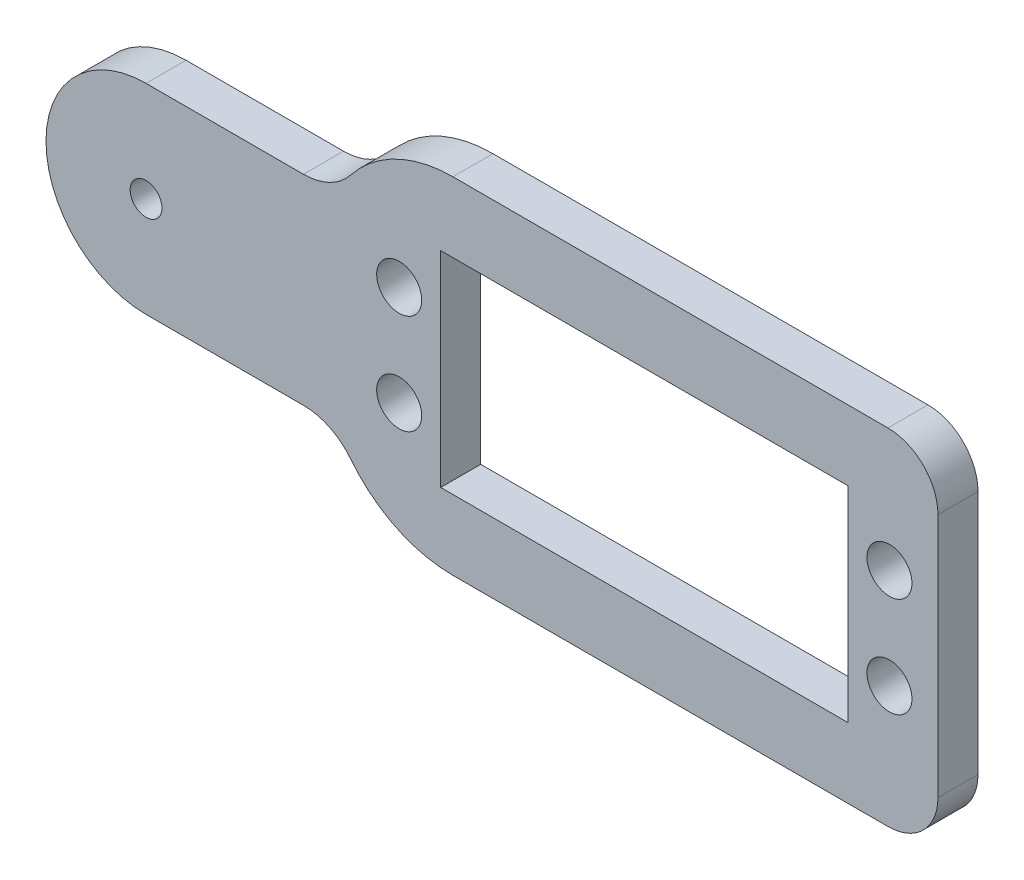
SolidWorks part; units mm, degrees
ref_plane "Front Plane" through (0, 0, 0) normal (0, 0, 1) x (1, 0, 0)
ref_plane "Top Plane" through (0, 0, 0) normal (0, 1, 0) x (1, 0, 0)
ref_plane "Right Plane" through (0, 0, 0) normal (1, 0, 0) x (0, 0, -1)
sketch "Sketch1" plane through (0, 0, 0) normal (0, 0, 1) x (1, 0, 0)
  line L0 (-59.8, 0) -> (29.35, 0) construction
  line L1 (29.35, -12.25) -> (29.35, 12.25)
  line L2 (24.35, 17.25) -> (-19.134, 17.25)
  line L3 (-34.0651, 10) -> (-49.8, 10)
  line L4 (-34.0651, -10) -> (-49.8, -10)
  line L5 (24.35, -17.25) -> (-19.134, -17.25)
  line L32 (-24.5, -5) -> (24.5, 5) construction
  line L33 (20.35, 10.25) -> (-20.35, 10.25)
  line L34 (20.35, 10.25) -> (20.35, -10.25)
  line L35 (20.35, -10.25) -> (-20.35, -10.25)
  line L36 (-20.35, 10.25) -> (-20.35, -10.25)
  line L37 (20.35, 10.25) -> (-20.35, -10.25) construction
  line L38 (20.35, -10.25) -> (-20.35, 10.25) construction
  arc A0 (-29.35, -12.2895) -> (-34.0651, -10) centre (-34.0651, -16) ccw
  arc A1 (29.35, 12.25) -> (24.35, 17.25) centre (24.35, 12.25) ccw
  arc A2 (-19.134, 17.25) -> (-29.35, 12.2895) centre (-19.134, 4.25) ccw
  arc A3 (-29.35, 12.2895) -> (-34.0651, 10) centre (-34.0651, 16) cw
  arc A4 (-49.8, 10) -> (-49.8, -10) centre (-49.8, 0) ccw
  arc A5 (-19.134, -17.25) -> (-29.35, -12.2895) centre (-19.134, -4.25) cw
  arc A6 (29.35, -12.25) -> (24.35, -17.25) centre (24.35, -12.25) cw
  circle A7 centre (-49.8, 0) radius 1.59
  circle A23 centre (-24.5, -5) radius 2.25
  circle A24 centre (24.5, -5) radius 2.25
  circle A25 centre (24.5, 5) radius 2.25
  circle A26 centre (-24.5, 5) radius 2.25
  point P0 (0, 0)
  point P36 (-49.8, 0)
  point P92 (0, 0)
  dimension "D5" = 4.5
  dimension "D6" = 5
  dimension "D7" = 10
  dimension "D12" = 3.18
  dimension "D10" = 13
  dimension "D14" = 6
  dimension "D1" = 49
  dimension "D2" = 40.7
  dimension "D3" = 20.5
  dimension "D4" = 10
  dimension "D8" = 7
  dimension "D9" = 9
  dimension "D11" = 49.8
  dimension "D15" = 9
extrude "Boss-Extrude1" add sketch "Sketch1" along normal blind 4
